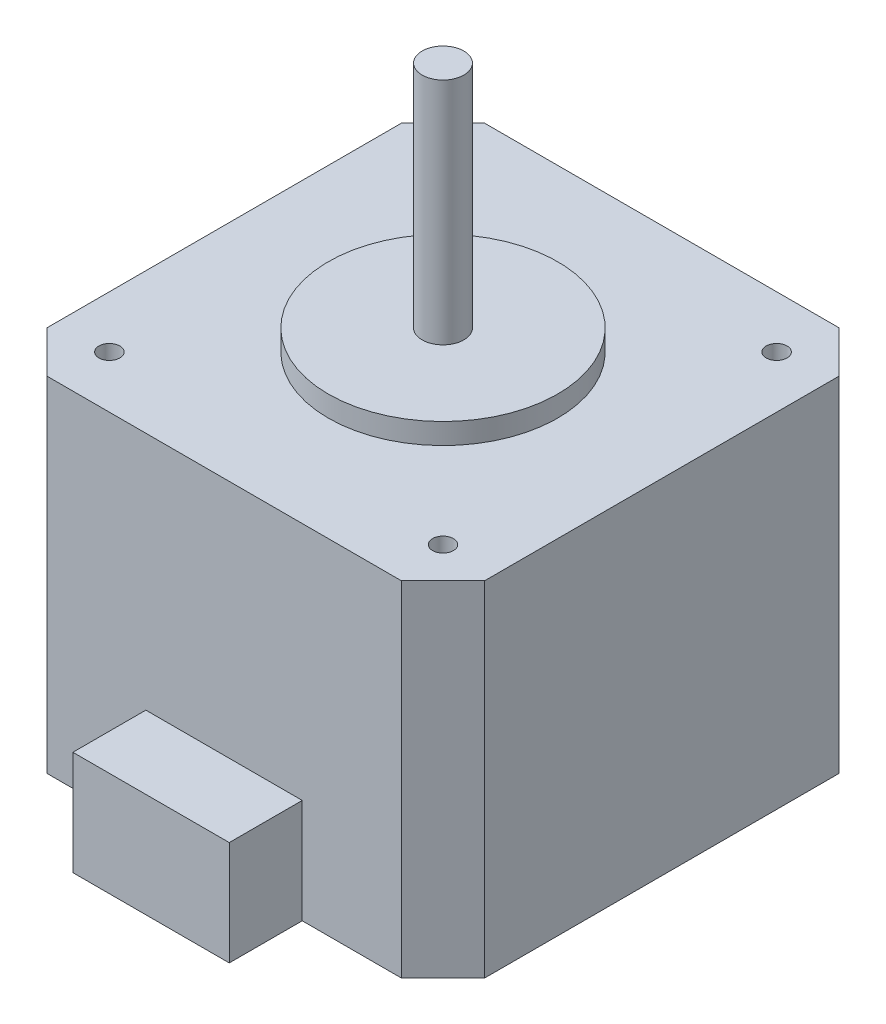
SolidWorks part; units mm, degrees
ref_plane "Front Plane" through (0, 0, 0) normal (0, 0, 1) x (1, 0, 0)
ref_plane "Top Plane" through (0, 0, 0) normal (0, 1, 0) x (1, 0, 0)
ref_plane "Right Plane" through (0, 0, 0) normal (1, 0, 0) x (0, 0, -1)
sketch "Sketch1" plane through (0, 0, 0) normal (0, 1, 0) x (1, 0, 0)
  line L1 (0, 0) -> (42, 0)
  line L2 (0, 0) -> (0, -42)
  line L3 (0, -42) -> (42, -42)
  line L4 (42, 0) -> (42, -42)
  point P4 (0, 0)
  dimension "D1" = 42
extrude "Boss-Extrude1" add sketch "Sketch1" along normal blind 33
sketch "Sketch2" plane through (0, 33, 0) normal (0, 1, 0) x (1, 0, 0)
  line L0 (42, 0) -> (0, 0) construction
  line L3 (42, -42) -> (42, 0) construction
  circle A0 centre (21, -21) radius 11
  point P4 (0, 0)
  point P5 (0, 0)
  point P6 (42, -28.0733)
  dimension "D1" = 22
  dimension "D2" = 21
  dimension "D3" = 21
extrude "Boss-Extrude2" add sketch "Sketch2" along normal blind 2 contours A0
sketch "Sketch3" plane through (0, 35, 0) normal (0, 1, 0) x (1, 0, 0)
  circle A0 centre (21, -21) radius 2
  circle A1 centre (21, -21) radius 11 construction
  dimension "D1" = 4
extrude "Boss-Extrude3" add sketch "Sketch3" along normal blind 22
sketch "Sketch4" plane through (0, 0, 42) normal (0, 0, 1) x (1, 0, 0)
  line L0 (0, 0) -> (42, 0) construction
  line L1 (13.5, 0) -> (28.5, 0)
  line L2 (13.5, 0) -> (13.5, 10)
  line L3 (13.5, 10) -> (28.5, 10)
  line L4 (28.5, 0) -> (28.5, 10)
  line L5 (42, 33) -> (42, 0) construction
  dimension "D1" = 15
  dimension "D2" = 13.5
  dimension "D3" = 10
extrude "Boss-Extrude4" add sketch "Sketch4" along normal blind 7
sketch "Sketch5" plane through (0, 33, 0) normal (0, 1, 0) x (1, 0, 0)
  line L0 (42, -42) -> (42, 0) construction
  line L1 (37, -5) -> (5, -5)
  line L2 (37, -5) -> (37, -37)
  line L3 (37, -37) -> (5, -37)
  line L4 (5, -5) -> (5, -37)
  line L5 (42, 0) -> (0, 0) construction
  line L6 (0, -42) -> (42, -42) construction
  line L7 (0, 0) -> (0, -42) construction
  dimension "D1" = 5
  dimension "D2" = 5
  dimension "D3" = 5
  dimension "D4" = 5
hole_wizard "Ø2.0mm Clearance Dowel Hole1" positions "3DSketch1" profile "Sketch6" hole size "Ø2.0" standard "ANSI Metric"
sketch3d "3DSketch1"
  point P0 (37, 33, 5)
  point P3 (37, 33, 37)
  point P6 (5, 33, 37)
  point P9 (5, 33, 5)
sketch "Sketch6" plane through (37, 33, 5) normal (1, 0, 0) x (0, 0, 1)
  line L0 (0, 0) -> (0, 8.6009)
  line L1 (0, 8.6009) -> (1, 8)
  line L2 (1, 8) -> (1, 0)
  line L5 (1, 0) -> (0, 0)
  line L10 (0, 8.6009) -> (-1, 8) construction
  line L11 (0, -6.35) -> (0, 107.95) construction
  dimension "Hole Dia." = 2
  dimension "Hole Depth" = 8
  dimension "Drill Angle" = 118
chamfer "Chamfer1" distance 4 angle 45 4 edges at (42, 16.5, 42) (0, 16.5, 42) (0, 16.5, 0) (42, 16.5, 0)
